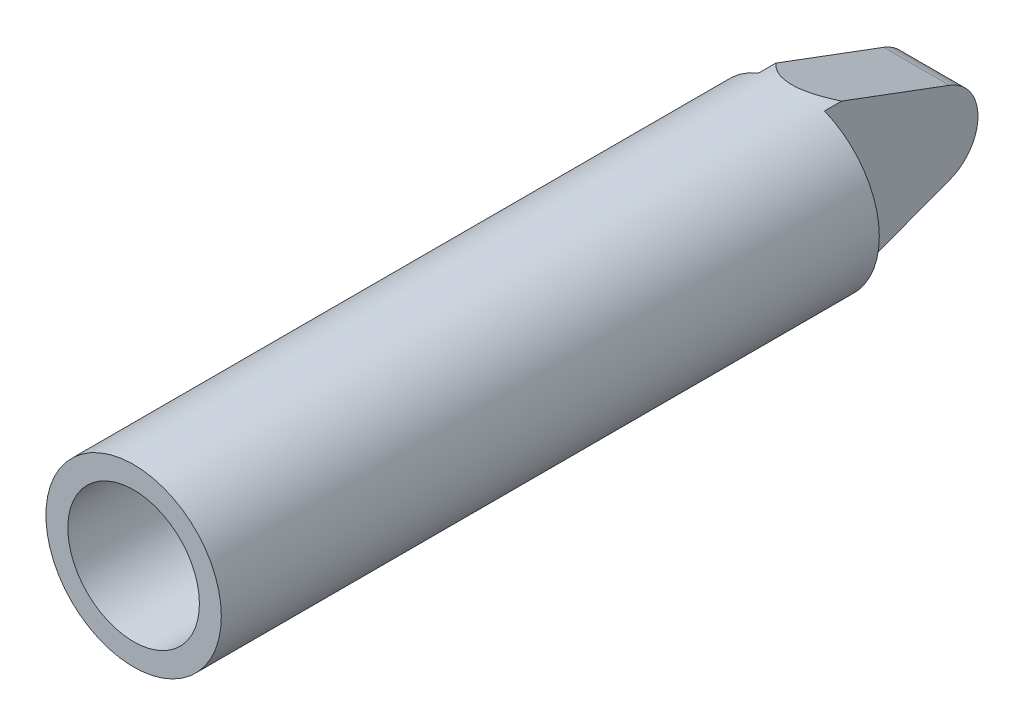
SolidWorks part; units mm, degrees
ref_plane "Ebene vorne" through (0, 0, 0) normal (0, 0, 1) x (1, 0, 0)
ref_plane "Ebene oben" through (0, 0, 0) normal (0, 1, 0) x (1, 0, 0)
ref_plane "Ebene rechts" through (0, 0, 0) normal (1, 0, 0) x (0, 0, -1)
sketch "Skizze2" plane through (0, 0, 0) normal (0, 0, 1) x (1, 0, 0)
  circle A0 centre (0, 0) radius 40
  dimension "D1" = 80
extrude "Linear austragen1" add sketch "Skizze2" along normal blind 300
sketch "Skizze3" plane through (0, 0, 0) normal (1, 0, 0) x (0, 0, -1)
  line L0 (0, 40) -> (56.9908, 18.7384)
  line L1 (50, 0) -> (0, 0) construction
  line L2 (0, -40) -> (56.9908, -18.7384)
  line L3 (0, -40) -> (0, 40) construction
  line L4 (0, 40) -> (0, -40)
  circle A0 centre (50, 0) radius 20
  dimension "D1" = 40
  dimension "D2" = 50
extrude "Linear austragen2" add sketch "Skizze3" along normal mid plane 30
shell "Wandung1" thickness 10
sketch "Skizze4" plane through (0, 0, 300) normal (0, 0, 1) x (1, 0, 0)
  circle A0 centre (0, 0) radius 40 construction
  circle A1 centre (0, 0) radius 40
extrude "Schnitt-Linear austragen1" cut sketch "Skizze4" against normal through all flip side to cut
